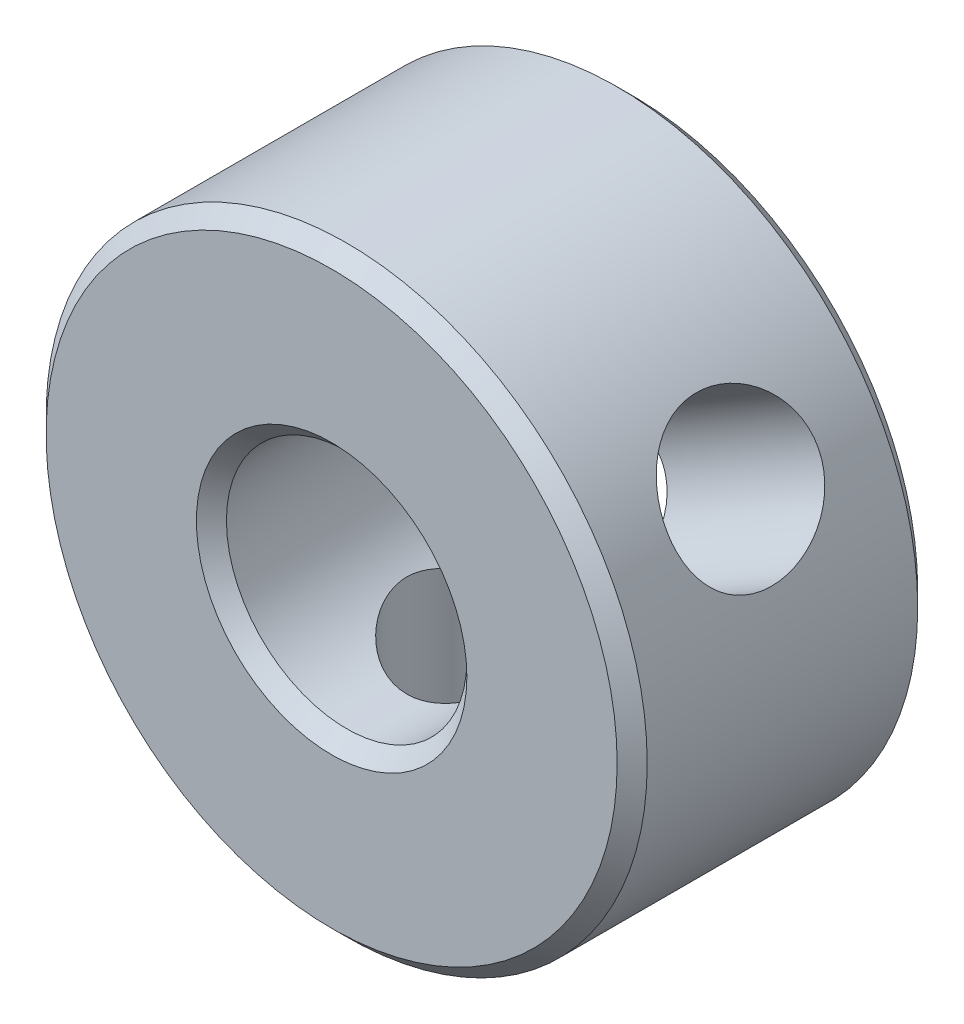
SolidWorks part; units mm, degrees
ref_plane "Front" through (0, 0, 0) normal (0, 0, 1) x (1, 0, 0)
ref_plane "Top" through (0, 0, 0) normal (0, 1, 0) x (1, 0, 0)
ref_plane "Right" through (0, 0, 0) normal (1, 0, 0) x (0, 0, -1)
sketch "Sketch1" plane through (0, 0, 0) normal (0, 0, 1) x (1, 0, 0)
  circle A0 centre (0, 0) radius 10
  circle A1 centre (0, 0) radius 4
  dimension "d" = 8
  dimension "D0" = 20
extrude "Base-Extrude" add sketch "Sketch1" against normal blind 10
chamfer "Chamfer1" distance 0.5 angle 45 2 edges at (10, 0, 0) (10, 0, -10)
sketch "Sketch2" plane through (0, 0, 0) normal (0, 1, 0) x (1, 0, 0)
  line L0 (9.5, 10) -> (-9.5, 10) construction
  line L1 (0, 3.5505) -> (0, -10.3547) construction
  circle A0 centre (0, 5) radius 2.5
  dimension "d0" = 5
  dimension "H/2" = 5
extrude "Hole" cut sketch "Sketch2" against normal through all
chamfer "EndChamfer" distance 0.5 angle 45 2 edges at (4, 0, -10) (4, 0, 0)
pattern_circular "HolePat" count 2 every 120 about axis through (0, 0, -10) along (0, 0, 1) of "Hole"
equation "\"H/2@Sketch2\" = \"H@Base-Extrude\" / 2"
